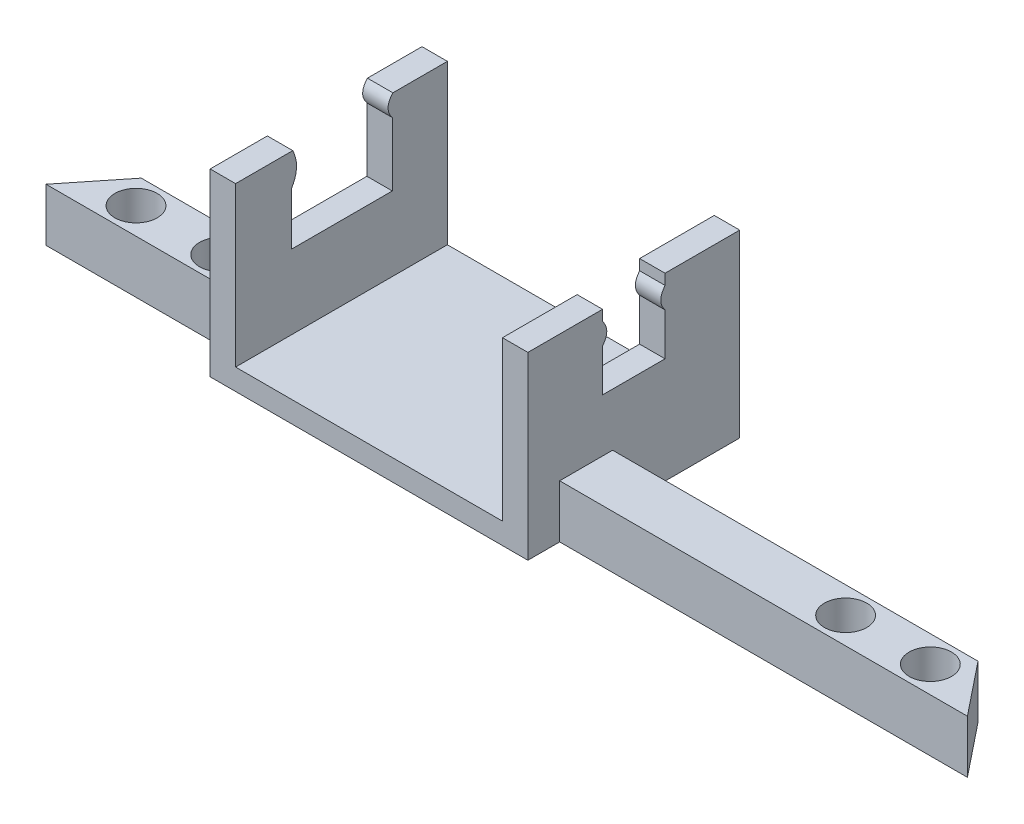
SolidWorks part; units mm, degrees
ref_plane "前视基准面" through (0, 0, 0) normal (0, 0, 1) x (1, 0, 0)
ref_plane "上视基准面" through (0, 0, 0) normal (0, 1, 0) x (1, 0, 0)
ref_plane "右视基准面" through (0, 0, 0) normal (1, 0, 0) x (0, 0, -1)
sketch "草图1" plane through (0, 0, 0) normal (0, 1, 0) x (1, 0, 0)
  line L1 (-15, 10) -> (15, 10)
  line L2 (-15, 10) -> (-15, -10)
  line L3 (-15, -10) -> (15, -10)
  line L4 (15, 10) -> (15, -10)
  line L5 (-15, 10) -> (15, -10) construction
  line L6 (-15, -10) -> (15, 10) construction
  point P0 (0, 0)
  dimension "D1" = 30
  dimension "D2" = 20
extrude "凸台-拉伸1" add sketch "草图1" along normal blind 2
sketch "草图2" plane through (-15, 0, 0) normal (-1, 0, 0) x (0, 0, 1)
  line L0 (-10, 2) -> (10, 2)
  line L1 (-10, 2) -> (-10, 17)
  line L2 (10, 2) -> (10, 17)
  line L3 (-10, 17) -> (-4.85, 17)
  line L4 (-4.8, 15.0006) -> (-4.8, 9.0002)
  line L5 (-4.8, 9.0002) -> (4.7, 9.0002)
  line L6 (4.7, 9.0002) -> (4.7, 14)
  line L7 (4.6, 17) -> (10, 17)
  spline S0 degree 2 poles (-4.85, 17) (-3.9754, 16.0184) (-4.8, 15.0006) knots 0 0 0 1 1 1
  spline S1 degree 2 poles (4.6, 17) (3.8446, 15.4063) (4.7, 14) knots 0 0 0 1 1 1
  point P8 (-4.4, 16.0006)
  point P11 (-4.8, 15.0006)
  point P13 (4.3, 15)
  point P14 (4.7, 14)
  dimension "D1" = 15
  dimension "D2" = 8
  dimension "D3" = 5.15
  dimension "D4" = 9.5
  dimension "D5" = 2
  dimension "D6" = 0.4
  dimension "D7" = 1
  dimension "D8" = 0.4
extrude "凸台-拉伸2" add sketch "草图2" against normal blind 2.4 separate body
sketch "草图3" plane through (15, 0, 0) normal (1, 0, 0) x (0, 0, -1)
  line L0 (-10, 2) -> (10, 2)
  line L1 (-10, 2) -> (-10, 17)
  line L2 (10, 2) -> (10, 17)
  line L3 (-10, 17) -> (-2.95, 17)
  line L4 (-2.95, 17) -> (-2.95, 16)
  line L5 (-2.95, 10) -> (2.95, 10)
  line L6 (2.95, 10) -> (2.95, 14)
  line L7 (2.95, 17) -> (10, 17)
  line L8 (-2.95, 14) -> (-2.95, 10)
  line L9 (2.95, 16) -> (2.95, 17)
  spline S0 degree 2 poles (-2.95, 16) (-2.15, 15) (-2.95, 14) knots 0 0 0 1 1 1
  spline S1 degree 2 poles (2.95, 16) (2.15, 15) (2.95, 14) knots 0 0 0 1 1 1
  point P10 (-2.95, 16)
  point P11 (-2.55, 15)
  point P12 (-2.95, 14)
  point P15 (2.95, 16)
  point P17 (2.55, 15)
  point P18 (2.95, 14)
  dimension "D1" = 15
  dimension "D2" = 7
  dimension "D3" = 5.9
  dimension "D4" = 7.05
  dimension "D5" = 0.4
  dimension "D6" = 4
  dimension "D7" = 5
  dimension "D8" = 6
  dimension "D9" = 0.4
  dimension "D10" = 4
  dimension "D11" = 5
  dimension "D12" = 6
extrude "凸台-拉伸3" add sketch "草图3" against normal blind 2.4
sketch "草图4" plane through (0, 0, 0) normal (0, -1, 0) x (1, 0, 0)
  line L0 (10, 0.0806) -> (10, -11.5199) construction
  line L1 (-29.5, 2) -> (49.5, 2)
  line L2 (-33.5, 7) -> (53.5, 7)
  line L3 (-29.5, 2) -> (-33.5, 7)
  line L4 (49.5, 2) -> (53.5, 7)
  line L6 (-15, 10) -> (12.6, 10) construction
  circle A0 centre (-27.5, 4.5) radius 2
  circle A1 centre (47.5, 4.5) radius 2
  circle A2 centre (-19.5, 4.5) radius 2
  circle A3 centre (39.5, 4.5) radius 2
  point P4 (10, 2)
  point P8 (10, 7)
  dimension "D5" = 4
  dimension "D6" = 2.5
  dimension "D11" = 4
  dimension "D13" = 4
  dimension "D1" = 79
  dimension "D2" = 87
  dimension "D3" = 3
  dimension "D4" = 5
  dimension "D7" = 6
  dimension "D8" = 2.5
  dimension "D9" = 75
  dimension "D10" = 10
  dimension "D12" = 8
  dimension "D14" = 8
extrude "凸台-拉伸4" add sketch "草图4" against normal blind 5
sketch "草图5" plane through (0, 5, 0) normal (0, 1, 0) x (1, 0, 0)
  line L4 (-12.6, -7) -> (12.6, -7)
  line L5 (12.6, -7) -> (12.6, -2)
  line L6 (12.6, -2) -> (-12.6, -2)
  line L7 (-12.6, -2) -> (-12.6, -7)
  line L8 (-12.6, -7) -> (12.6, -7)
  line L9 (12.6, -7) -> (12.6, -2)
  line L10 (12.6, -2) -> (-12.6, -2)
  line L11 (-12.6, -2) -> (-12.6, -7)
  dimension "D1" = 0
extrude "切除-拉伸1" cut sketch "草图5" against normal up to surface (3 mm away)
